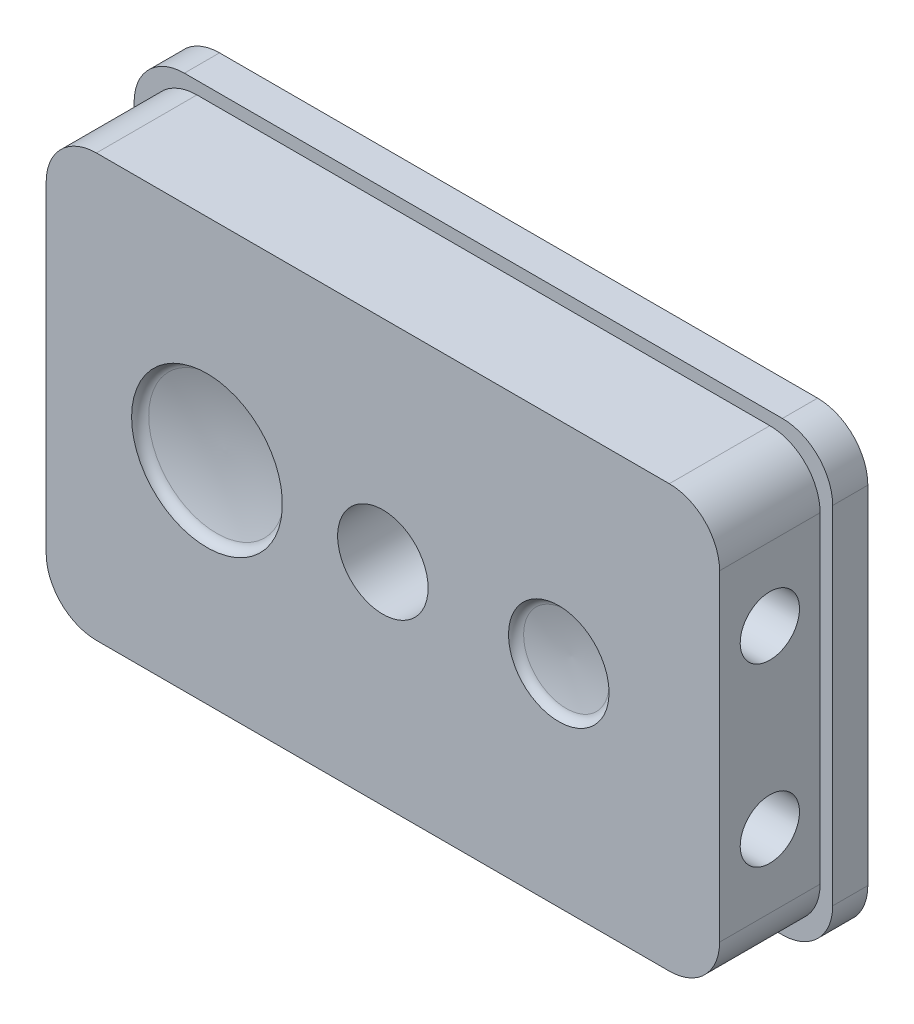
SolidWorks part; units mm, degrees
ref_plane "Plan de face" through (0, 0, 0) normal (0, 0, 1) x (1, 0, 0)
ref_plane "Plan de dessus" through (0, 0, 0) normal (0, 1, 0) x (1, 0, 0)
ref_plane "Plan de droite" through (0, 0, 0) normal (1, 0, 0) x (0, 0, -1)
sketch "Esquisse1" plane through (0, 0, 0) normal (0, 0, 1) x (1, 0, 0)
  line L1 (-69.5, -44.5) -> (69.5, -44.5)
  line L2 (-69.5, -44.5) -> (-69.5, 44.5)
  line L3 (-69.5, 44.5) -> (69.5, 44.5)
  line L4 (69.5, -44.5) -> (69.5, 44.5)
  dimension "D1" = 89
  dimension "D2" = 139
  dimension "D3" = 44.5
  dimension "D4" = 69.5
extrude "Extrusion1" add sketch "Esquisse1" along normal blind 7
sketch "Esquisse2" plane through (0, 0, 7) normal (0, 0, 1) x (1, 0, 0)
  line L1 (-67, 42) -> (67, 42)
  line L2 (-67, 42) -> (-67, -42)
  line L3 (-67, -42) -> (67, -42)
  line L4 (67, 42) -> (67, -42)
  dimension "D1" = 134
  dimension "D2" = 84
  dimension "D3" = 67
  dimension "D4" = 42
extrude "Extrusion2" add sketch "Esquisse2" along normal blind 20
fillet "Congé1" radius 10 4 edges at (-67, 42, 17) (-67, -42, 17) (67, 42, 17) (67, -42, 17)
fillet "Congé2" radius 10 4 edges at (69.5, 44.5, 3.5) (69.5, -44.5, 3.5) (-69.5, 44.5, 3.5) (-69.5, -44.5, 3.5)
sketch "Esquisse3" plane through (0, 0, 27) normal (0, 0, 1) x (1, 0, 0)
  circle A0 centre (0, 0) radius 9
  dimension "D1" = 18
extrude "Enlèv. mat.-Extru.1" cut sketch "Esquisse3" against normal through all
sketch "Esquisse4" plane through (-67, 0, 0) normal (-1, 0, 0) x (0, 0, 1)
  line L0 (27, 32) -> (27, -32) construction
  line L1 (0, 34.5) -> (0, -34.5) construction
  circle A0 centre (17, 17.5) radius 4
  point P4 (0, 0)
  dimension "D1" = 10
  dimension "D2" = 8
  dimension "D3" = 17.5
extrude "Enlèv. mat.-Extru.2" cut sketch "Esquisse4" against normal through all
sketch "Esquisse5" plane through (-67, 0, 0) normal (-1, 0, 0) x (0, 0, 1)
  line L0 (27, 32) -> (27, -32) construction
  circle A0 centre (17, -17.5) radius 4
  circle A1 centre (17, 17.5) radius 4 construction
  dimension "D1" = 10
  dimension "D2" = 8
  dimension "D3" = 35
extrude "Enlèv. mat.-Extru.3" cut sketch "Esquisse5" against normal blind 57.5
sketch "Esquisse6" plane through (67, 0, 0) normal (1, 0, 0) x (0, 0, -1)
  line L0 (-27, -32) -> (-27, 32) construction
  circle A0 centre (-17, -17.5) radius 4
  circle A1 centre (-17, 17.5) radius 4 construction
  dimension "D1" = 8
  dimension "D2" = 10
  dimension "D3" = 35
extrude "Enlèv. mat.-Extru.4" cut sketch "Esquisse6" against normal blind 57.5
sketch "Esquisse7" plane through (0, -42, 0) normal (0, -1, 0) x (1, 0, 0)
  line L0 (-57, 27) -> (57, 27) construction
  line L1 (-59.5, 0) -> (59.5, 0) construction
  circle A0 centre (-52.5, 17) radius 4
  circle A1 centre (52.5, 17) radius 4
  point P6 (0, 0)
  dimension "D1" = 8
  dimension "D2" = 8
  dimension "D3" = 10
  dimension "D4" = 10
  dimension "D5" = 105
  dimension "D6" = 52.5
extrude "Enlèv. mat.-Extru.5" cut sketch "Esquisse7" against normal blind 67.5
sketch "Esquisse9" plane through (0, -42, 0) normal (0, -1, 0) x (1, 0, 0)
  line L0 (-59.5, 0) -> (59.5, 0) construction
  line L1 (-57, 27) -> (57, 27) construction
  circle A0 centre (-17.5, 17) radius 5.9
  circle A1 centre (17.5, 17) radius 5.9
  point P4 (0, 0)
  dimension "D1" = 11.8
  dimension "D2" = 11.8
  dimension "D3" = 35
  dimension "D4" = 17.5
  dimension "D5" = 10
  dimension "D6" = 10
extrude "Enlèv. mat.-Extru.6" cut sketch "Esquisse9" against normal blind 24.5
sketch "Esquisse10" plane through (-67, 0, 0) normal (-1, 0, 0) x (0, 0, 1)
  circle A0 centre (17, 17.5) radius 5.9
  circle A1 centre (17, -17.5) radius 5.9
  dimension "D1" = 11.8
  dimension "D2" = 11.8
extrude "Enlèv. mat.-Extru.7" cut sketch "Esquisse10" against normal blind 10
sketch "Esquisse11" plane through (0, -42, 0) normal (0, -1, 0) x (1, 0, 0)
  circle A0 centre (52.5, 17) radius 5.9
  circle A1 centre (-52.5, 17) radius 5.9
  dimension "D1" = 11.8
  dimension "D2" = 11.8
extrude "Enlèv. mat.-Extru.8" cut sketch "Esquisse11" against normal blind 10
sketch "Esquisse12" plane through (67, 0, 0) normal (1, 0, 0) x (0, 0, -1)
  circle A0 centre (-17, -17.5) radius 5.9
  circle A1 centre (-17, 17.5) radius 5.9
  dimension "D1" = 11.8
  dimension "D2" = 11.8
extrude "Enlèv. mat.-Extru.9" cut sketch "Esquisse12" against normal blind 10
sketch "Esquisse13" plane through (0, 0, 0) normal (0, 1, 0) x (1, 0, 0)
  line L0 (35, -19.4567) -> (35, -33.8783) construction
  line L1 (57, -27) -> (-57, -27) construction
  line L2 (35, -24.5) -> (35, -27)
  line L3 (35, -27) -> (45, -27)
  arc A0 (45, -27) -> (43.5, -25.4934) centre (43.0494, -27.442) ccw
  arc A1 (43.5, -25.4934) -> (35, -24.5) centre (33.4674, -74.4765) ccw
  point P2 (45, -27)
  point P4 (35, -24.5)
  dimension "D4" = 2
  dimension "D5" = 50
  dimension "D1" = 35
  dimension "D2" = 10
  dimension "D3" = 2.5
  dimension "D6" = 1.5
revolve "Enlèvement de matière-Révolution2" cut sketch "Esquisse13" angle 360 about L0
sketch "Esquisse14" plane through (0, 0, 0) normal (0, 1, 0) x (1, 0, 0)
  line L0 (-35, -18.3768) -> (-35, -38.4886) construction
  line L1 (57, -27) -> (-57, -27) construction
  line L2 (-35, -23.4) -> (-35, -27)
  line L3 (-35, -27) -> (-20, -27)
  arc A0 (-20, -27) -> (-21.5, -25.0876) centre (-21.9999, -27.0241) ccw
  arc A1 (-21.5, -25.0876) -> (-35, -23.4) centre (-34.3945, -73.3963) ccw
  point P2 (-35, -23.4)
  point P6 (-20, -27)
  dimension "D4" = 2
  dimension "D5" = 50
  dimension "D1" = 35
  dimension "D2" = 3.6
  dimension "D3" = 15
  dimension "D6" = 1.5
revolve "Enlèvement de matière-Révolution3" cut sketch "Esquisse14" angle 360 about L0
